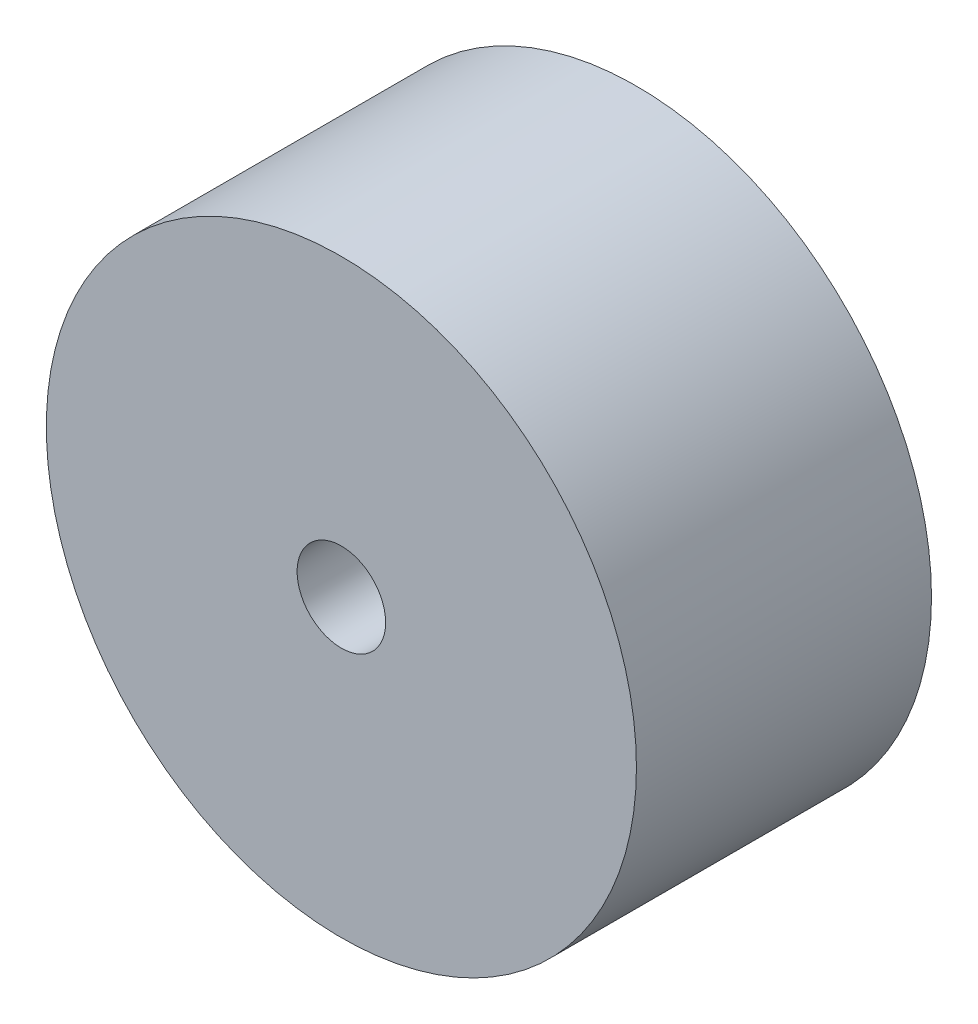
SolidWorks part; units mm, degrees
ref_plane "Plan de face" through (0, 0, 0) normal (0, 0, 1) x (1, 0, 0)
ref_plane "Plan de dessus" through (0, 0, 0) normal (0, 1, 0) x (1, 0, 0)
ref_plane "Plan de droite" through (0, 0, 0) normal (1, 0, 0) x (0, 0, -1)
sketch "Esquisse1" plane through (0, 0, 0) normal (0, 0, 1) x (1, 0, 0)
  circle A0 centre (0, 0) radius 20
  dimension "D1" = 40
extrude "Extrusion1" add sketch "Esquisse1" along normal blind 20
sketch "Esquisse4" plane through (0, 0, 20) normal (0, 0, 1) x (1, 0, 0)
  circle A0 centre (0, 0) radius 3
  dimension "D1" = 6
extrude "Enlèv. mat.-Extru.1" cut sketch "Esquisse4" against normal blind 7
